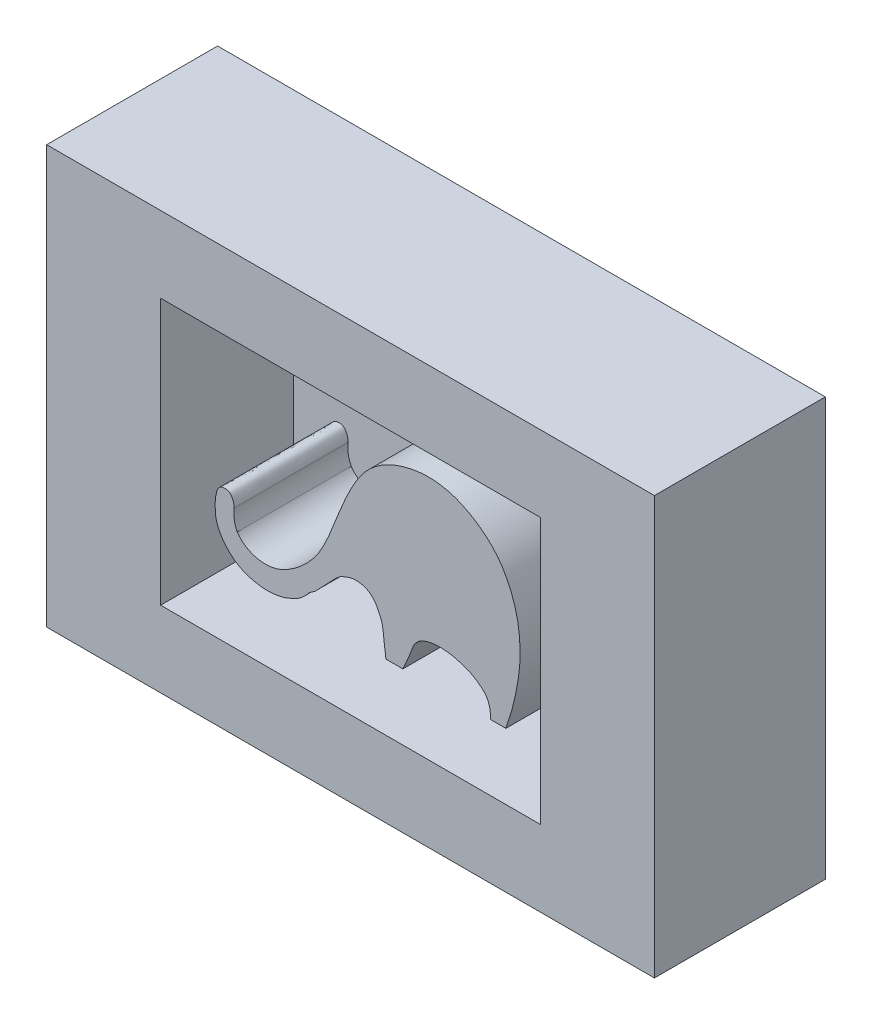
SolidWorks part; units mm, degrees
ref_plane "Alzado" through (0, 0, 0) normal (0, 0, 1) x (1, 0, 0)
ref_plane "Planta" through (0, 0, 0) normal (0, 1, 0) x (1, 0, 0)
ref_plane "Vista lateral" through (0, 0, 0) normal (1, 0, 0) x (0, 0, -1)
sketch "Croquis1" plane through (0, 0, 0) normal (0, 0, 1) x (1, 0, 0)
  line L1 (-80, -55) -> (80, -55)
  line L2 (-80, -55) -> (-80, 55)
  line L3 (-80, 55) -> (80, 55)
  line L4 (80, -55) -> (80, 55)
  line L5 (-80, -55) -> (80, 55) construction
  line L6 (-80, 55) -> (80, -55) construction
  point P0 (0, 0)
  dimension "D1" = 160
  dimension "D2" = 110
extrude "Saliente-Extruir1" add sketch "Croquis1" along normal blind 45
sketch "Croquis2" plane through (0, 0, 45) normal (0, 0, 1) x (1, 0, 0)
  line L1 (-50, -35) -> (50, -35)
  line L2 (-50, -35) -> (-50, 35)
  line L3 (-50, 35) -> (50, 35)
  line L4 (50, -35) -> (50, 35)
  line L5 (-50, -35) -> (50, 35) construction
  line L6 (-50, 35) -> (50, -35) construction
  point P0 (0, 0)
  dimension "D1" = 100
  dimension "D2" = 70
extrude "Cortar-Extruir1" cut sketch "Croquis2" against normal blind 35
sketch "Croquis3" plane through (0, 0, 10) normal (0, 0, 1) x (1, 0, 0)
  line L0 (35.8957, -22.6352) -> (31.7948, -22.6352)
  line L1 (8.7807, -22.6352) -> (4.3127, -22.6352)
  spline S0 degree 3 poles (-34.8253, -13.2227) (-33.8453, -14.7163) (-30.6266, -16.8623) (-24.7718, -17.0723) (-18.7377, -13.6281) (-13.2098, -7.9741) (-9.4362, 0.9198) (-5.9649, 10.1931) (-0.3957, 19.4807) (8.9598, 24.2563) (19.047, 25.0426) (28.0401, 21.1556) (33.936, 15.7918) (37.4442, 9.3745) (39.0903, 4.0524) (39.6786, -1.6019) (39.6893, -6.1749) (38.9563, -11.1211) (37.9229, -16.5266) (36.6368, -20.408) (35.8957, -22.6352) knots 0.065911 0.065911 0.065911 0.065911 0.103722 0.140927 0.184354 0.246171 0.305056 0.386129 0.457328 0.526829 0.599384 0.663992 0.728424 0.763825 0.817577 0.844806 0.883813 0.913819 0.95035 1 1 1 1
  spline S1 degree 3 poles (31.7948, -22.6352) (31.9097, -21.1065) (31.555, -18.3228) (28.8799, -15.9618) (26.491, -14.4879) (23.6101, -13.4861) (20.4007, -12.7534) (17.2275, -12.7446) (14.922, -13.2456) (13.142, -13.9881) (11.4107, -15.6676) (10.8795, -17.9331) (10.0887, -19.6408) (9.5143, -20.9709) (9.0697, -21.9711) (8.7807, -22.6352) knots 0 0 0 0 0.140024 0.225018 0.307165 0.388944 0.494077 0.598247 0.667491 0.702035 0.7686 0.871495 0.902849 0.935748 1 1 1 1
  spline S2 degree 3 poles (4.3127, -22.6352) (4.1554, -21.1465) (3.7197, -18.5034) (3.513, -15.0269) (2.4507, -12.8265) (1.7313, -11.3775) (0.9059, -10.3776) (-0.1138, -9.4549) (-1.5343, -8.8036) (-3.0204, -8.5739) (-4.2861, -8.6386) (-5.3329, -8.8005) (-6.2887, -9.2569) (-7.3239, -9.5682) (-8.2284, -10.2183) (-9.3298, -11.2467) (-10.519, -12.4827) (-11.8331, -13.8676) (-12.8161, -14.9189) (-13.6169, -15.7308) (-14.5887, -16.832) (-15.811, -17.2941) (-16.7936, -18.7566) (-17.1134, -18.928) knots 0 0 0 0 0.127318 0.230881 0.292327 0.334372 0.368783 0.402437 0.451161 0.49979 0.529441 0.559404 0.589437 0.619469 0.651142 0.683329 0.748431 0.797525 0.846618 0.871106 0.895593 0.968875 1 1 1 1
  spline S3 degree 3 poles (-17.1134, -18.928) (-18.0353, -19.9192) (-19.4586, -20.87) (-21.3304, -21.5487) (-22.4437, -22.0253) (-23.8725, -22.3465) (-25.5578, -22.5962) (-27.8663, -22.6738) (-30.2774, -22.2932) (-32.5879, -21.6727) (-34.2075, -20.8748) (-35.6698, -19.9671) (-37.029, -18.7961) (-38.2282, -17.4414) (-39.2295, -15.9504) (-40.084, -14.276) (-40.5825, -12.4453) (-40.5932, -10.9394) (-40.705, -9.7007) (-40.5557, -8.8196) (-40.5463, -7.8252) (-40.3401, -7.2855) (-40.2523, -6.9692) knots 0 0 0 0 0.089006 0.110192 0.131378 0.168789 0.206308 0.243785 0.32071 0.366379 0.401059 0.439407 0.479698 0.518947 0.558459 0.597894 0.642643 0.68198 0.69704 0.724442 0.740595 0.762141 0.762141 0.762141 0.762141
  spline S4 degree 3 poles (-35.6138, -8.125) (-35.8698, -9.935) (-35.6069, -11.6343) (-34.8253, -13.2227) knots 0.122665 0.122665 0.122665 0.122665 0.566029 0.566029 0.566029 0.566029
  spline S5 degree 3 poles (-40.2523, -6.9692) (-40.2328, -6.2711) (-39.5502, -5.0611) (-38.025, -4.8483) (-36.9054, -5.0337) (-35.9354, -6.2084) (-35.6545, -7.3015) (-35.6138, -8.125) knots 0 0 0 0 0.272952 0.450464 0.560639 0.693814 1 1 1 1
extrude "Saliente-Extruir2" add sketch "Croquis3" along normal blind 30
